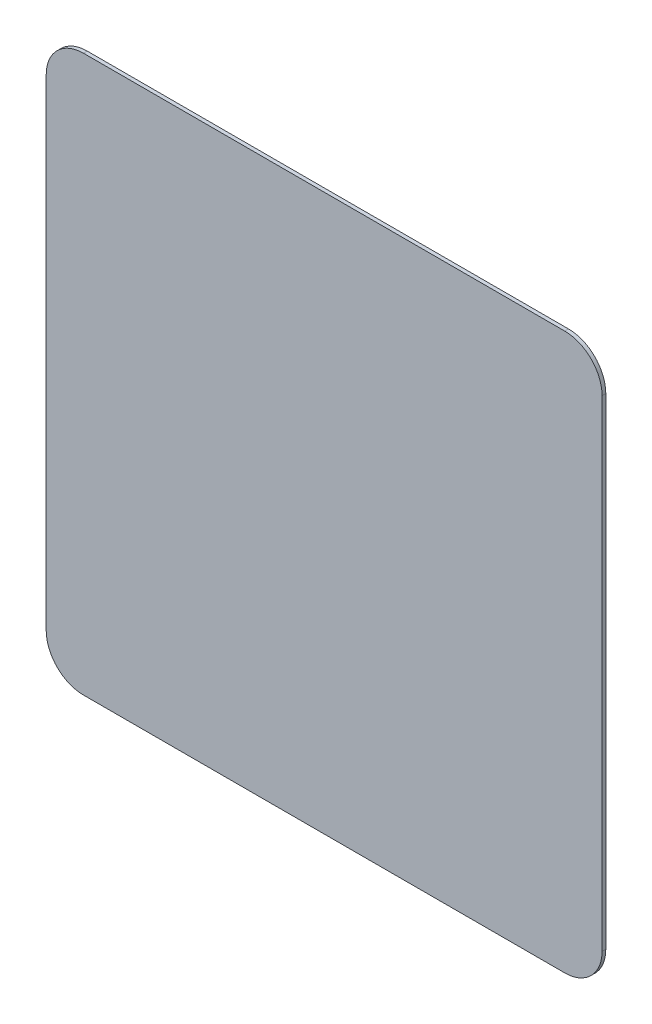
SolidWorks part; units mm, degrees
ref_plane "Front" through (0, 0, 0) normal (0, 0, 1) x (1, 0, 0)
ref_plane "Top" through (0, 0, 0) normal (0, 1, 0) x (1, 0, 0)
ref_plane "Right" through (0, 0, 0) normal (1, 0, 0) x (0, 0, -1)
sketch "Sketch1" plane through (0, 0, 0) normal (0, 0, 1) x (1, 0, 0)
  line L1 (-32.9325, 19.3061) -> (18.6675, 19.3061)
  line L2 (-36.9325, 15.3061) -> (-36.9325, -36.2939)
  line L3 (-32.9325, -40.2939) -> (18.6675, -40.2939)
  line L4 (22.6675, 15.3061) -> (22.6675, -36.2939)
  arc A0 (-36.9325, 15.3061) -> (-32.9325, 19.3061) centre (-32.9325, 15.3061) cw
  arc A1 (-36.9325, -36.2939) -> (-32.9325, -40.2939) centre (-32.9325, -36.2939) ccw
  arc A2 (18.6675, -40.2939) -> (22.6675, -36.2939) centre (18.6675, -36.2939) ccw
  arc A3 (18.6675, 19.3061) -> (22.6675, 15.3061) centre (18.6675, 15.3061) cw
  point P6 (-36.9325, 19.3061)
  point P9 (-36.9325, -40.2939)
  point P14 (22.6675, 19.3061)
  dimension "D3" = 4
  dimension "D1" = 59.6
  dimension "D2" = 59.6
extrude "Boss-Extrude1" add sketch "Sketch1" along normal blind 0.4
sketch "Sketch2" plane through (0, 0, 0) normal (0, 0, 1) x (1, 0, 0)
  line L0 (22.6675, -36.2939) -> (22.6675, 15.3061) construction
  line L1 (17.8675, 16.1061) -> (-32.1325, 16.1061)
  line L2 (19.4675, 14.5061) -> (19.4675, -35.4939)
  line L3 (17.8675, -37.0939) -> (-32.1325, -37.0939)
  line L4 (-33.7325, 14.5061) -> (-33.7325, -35.4939)
  line L5 (18.6675, 19.3061) -> (-32.9325, 19.3061) construction
  line L6 (-36.9325, 15.3061) -> (-36.9325, -36.2939) construction
  line L7 (-32.9325, -40.2939) -> (18.6675, -40.2939) construction
  arc A0 (-33.7325, 14.5061) -> (-32.1325, 16.1061) centre (-32.1325, 14.5061) cw
  arc A1 (17.8675, 16.1061) -> (19.4675, 14.5061) centre (17.8675, 14.5061) cw
  arc A2 (-33.7325, -35.4939) -> (-32.1325, -37.0939) centre (-32.1325, -35.4939) ccw
  arc A3 (17.8675, -37.0939) -> (19.4675, -35.4939) centre (17.8675, -35.4939) ccw
  dimension "D5" = 1.6
  dimension "D1" = 3.2
  dimension "D2" = 3.2
  dimension "D3" = 3.2
  dimension "D4" = 3.2
